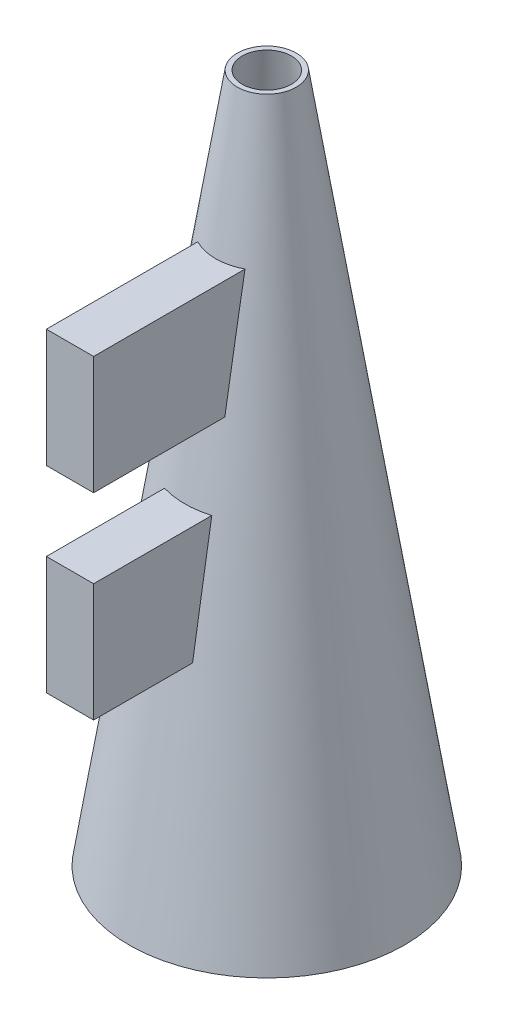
SolidWorks part; units mm, degrees
ref_plane "Front Plane" through (0, 0, 0) normal (0, 0, 1) x (1, 0, 0)
ref_plane "Top Plane" through (0, 0, 0) normal (0, 1, 0) x (1, 0, 0)
ref_plane "Right Plane" through (0, 0, 0) normal (1, 0, 0) x (0, 0, -1)
sketch "Sketch1" plane through (0, 0, 0) normal (0, 0, 1) x (1, 0, 0)
  line L0 (0, 0) -> (0, 35000) construction
  line L1 (6750, 0) -> (1250, 35000)
  line L2 (1250, 35000) -> (1500, 35000)
  line L3 (1500, 35000) -> (7000, 0)
  line L4 (7000, 0) -> (6750, 0)
revolve "Revolve1" add sketch "Sketch1" angle 360 about L0
sketch "Sketch2" plane through (0, 0, 0) normal (0, 0, 1) x (1, 0, 0)
  line L1 (-1200, 12000) -> (1200, 12000)
  line L2 (-1200, 12000) -> (-1200, 18000)
  line L3 (-1200, 18000) -> (1200, 18000)
  line L4 (1200, 12000) -> (1200, 18000)
  line L5 (-1200, 22000) -> (1200, 22000)
  line L6 (-1200, 22000) -> (-1200, 28000)
  line L7 (-1200, 28000) -> (1200, 28000)
  line L8 (1200, 22000) -> (1200, 28000)
extrude "Boss-Extrude1" add sketch "Sketch2" along normal blind 10000
